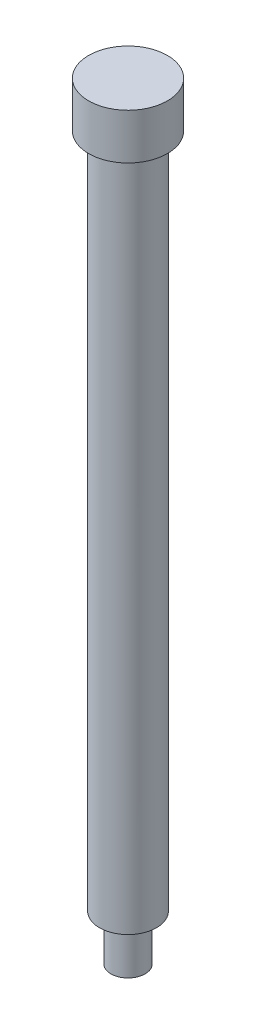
SolidWorks part; units mm, degrees
ref_plane "Front" through (0, 0, 0) normal (0, 0, 1) x (1, 0, 0)
ref_plane "Top" through (0, 0, 0) normal (0, 1, 0) x (1, 0, 0)
ref_plane "Right" through (0, 0, 0) normal (1, 0, 0) x (0, 0, -1)
sketch "Sketch1" plane through (0, 0, 0) normal (0, 0, 1) x (1, 0, 0)
  line L0 (0, 498.0111) -> (0, 282.1111) construction
  line L1 (0, 282.1111) -> (-7.9375, 282.1111) construction
  line L2 (-7.9375, 282.1111) -> (-7.9375, 482.7711) construction
  line L3 (-10.9538, 482.7711) -> (0, 482.7711) construction
  line L4 (-10.9538, 495.4711) -> (-10.9537, 371.0111) construction
  line L5 (-10.9538, 495.4711) -> (0, 495.4711) construction
  line L6 (0, 495.4711) -> (0, 282.1111)
  line L7 (0, 282.1111) -> (-7.9375, 282.1111)
  line L8 (-7.9375, 282.1111) -> (-7.9375, 482.7711)
  line L9 (-10.9538, 482.7711) -> (-7.9375, 482.7711)
  line L10 (-10.9538, 495.4711) -> (-10.9538, 482.7711)
  line L11 (-10.9538, 495.4711) -> (0, 495.4711)
  line L12 (0, 310.6861) -> (0, 454.6494) construction
  line L13 (0, 310.6861) -> (0, 454.6494) construction
revolve "Base-Revolve" add sketch "Sketch1" angle 360 about L13
sketch "Sketch2" plane through (0, 0, 0) normal (0, 0, 1) x (1, 0, 0)
  line L0 (0, 498.0111) -> (0, 282.1111) construction
  line L1 (0, 498.0111) -> (0, 282.1111) construction
  line L2 (0, 282.1111) -> (-7.9375, 282.1111) construction
  line L3 (-7.9375, 282.1111) -> (-7.9375, 482.7711) construction
  line L4 (-4.7625, 294.8111) -> (-7.9375, 294.8111) construction
  line L5 (-4.7625, 292.8807) -> (-4.7625, 282.1111) construction
  line L6 (-4.7625, 282.1111) -> (-7.9375, 282.1111)
  line L7 (-7.9375, 282.1111) -> (-7.9375, 294.8111)
  line L8 (-4.7625, 294.8111) -> (-7.9375, 294.8111)
  line L9 (-4.7625, 292.8807) -> (-4.7625, 282.1111)
  line L10 (-3.9751, 294.0237) -> (-3.9751, 293.6681) construction
  line L11 (-3.9751, 294.0237) -> (-3.9751, 293.6681)
  arc A0 (-3.9751, 294.0237) -> (-4.7625, 294.8111) centre (-4.7625, 294.0237) ccw construction
  arc A1 (-4.7625, 292.8807) -> (-3.9751, 293.6681) centre (-4.7625, 293.6681) ccw construction
  arc A2 (-3.9751, 294.0237) -> (-4.7625, 294.8111) centre (-4.7625, 294.0237) ccw
  arc A3 (-4.7625, 292.8807) -> (-3.9751, 293.6681) centre (-4.7625, 293.6681) ccw
revolve "3/8-24 UNF-2A" cut sketch "Sketch2" angle 360 about L1
